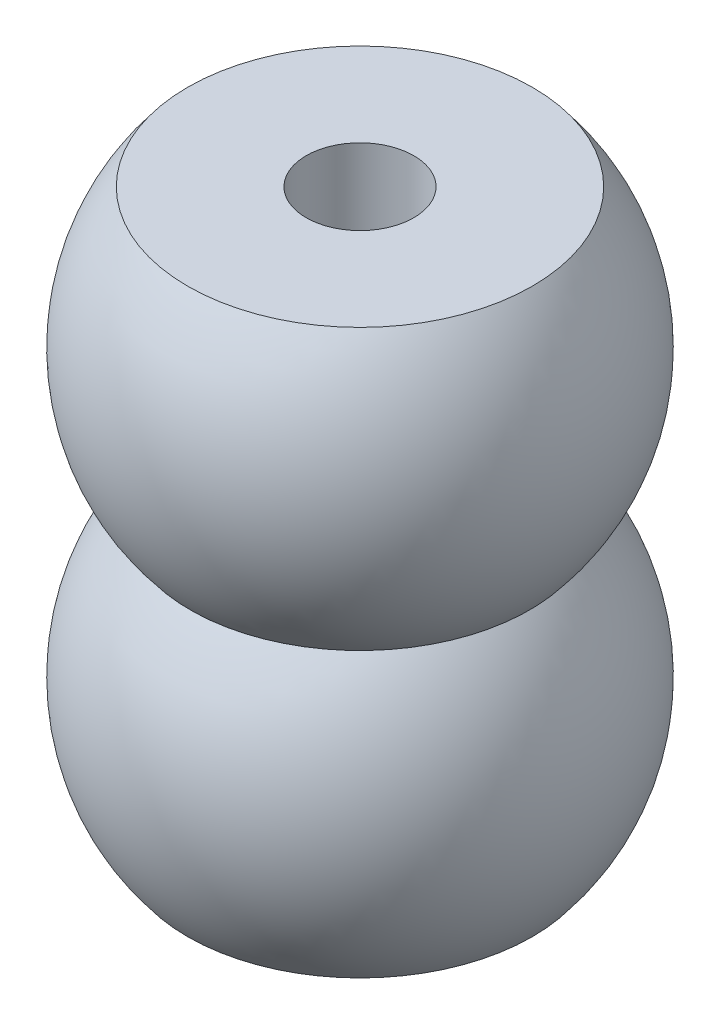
SolidWorks part; units mm, degrees
ref_plane "Face" through (0, 0, 0) normal (0, 0, 1) x (1, 0, 0)
ref_plane "Dessus" through (0, 0, 0) normal (0, 1, 0) x (1, 0, 0)
ref_plane "Droite" through (0, 0, 0) normal (1, 0, 0) x (0, 0, -1)
sketch "Esquisse1" plane through (0, 0, 0) normal (0, 0, 1) x (1, 0, 0)
  line L0 (-27.2213, 89) -> (-8.5, 89)
  line L1 (-27.2213, 0) -> (-8.5, 0)
  line L3 (-8.5, 89) -> (-8.5, 0)
  line L6 (0, -3.0776) -> (0, 122.4834) construction
  arc A2 (-26.8095, 44.5) -> (-27.2213, 0) centre (0, 22) ccw
  arc A3 (-27.2213, 89) -> (-26.8095, 44.5) centre (0, 67) ccw
  dimension "D2" = 35
  dimension "D1" = 8.5
  dimension "D4" = 22
  dimension "D5" = 22
  dimension "D6" = 45
revolve "Base-Révolution" add sketch "Esquisse1" angle 360 about L6
